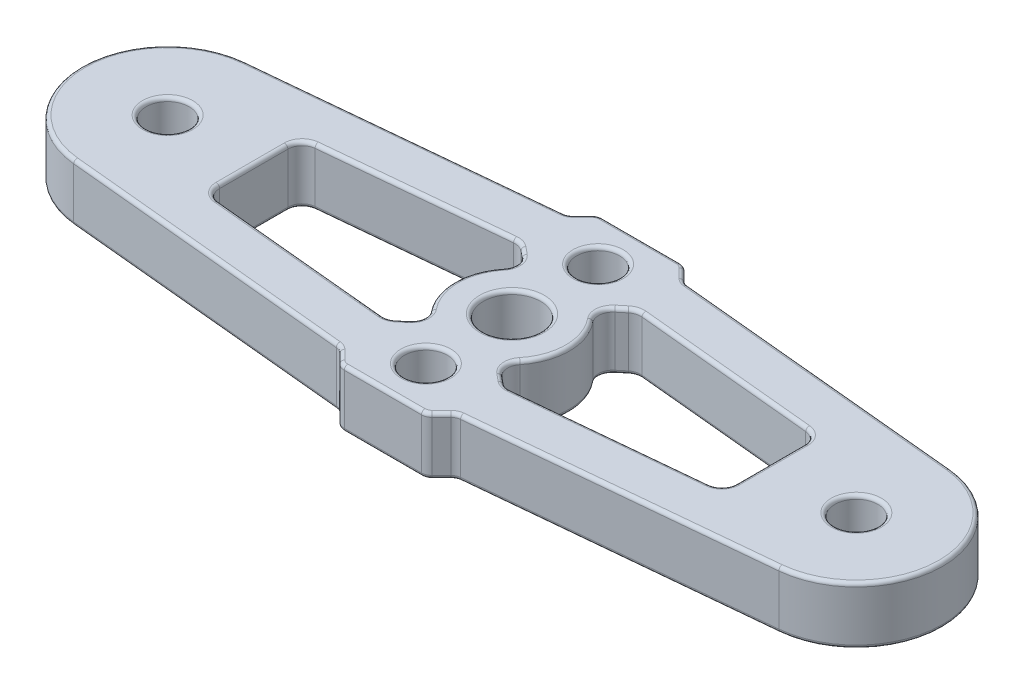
SolidWorks part; units mm, degrees
ref_plane "Ebene vorne" through (0, 0, 0) normal (0, 0, 1) x (1, 0, 0)
ref_plane "Ebene oben" through (0, 0, 0) normal (0, 1, 0) x (1, 0, 0)
ref_plane "Ebene rechts" through (0, 0, 0) normal (1, 0, 0) x (0, 0, -1)
sketch "Skizze1" plane through (0, 0, 0) normal (0, 1, 0) x (1, 0, 0)
  line L0 (0, 0) -> (24, 0) construction
  line L1 (24, 0) -> (24, 6) construction
  line L2 (24, 0) -> (24, -6) construction
  line L3 (24, 0) -> (48, 0) construction
  line L4 (24, 0) -> (24, 9) construction
  line L5 (21, 9) -> (27, 9)
  line L6 (21, -9) -> (27, -9)
  line L7 (21, 9) -> (19.9393, 7.9393)
  line L8 (27, 9) -> (28.0607, 7.9393)
  line L9 (27, -9) -> (28.0607, -7.9393)
  line L10 (21, -9) -> (19.9393, -7.9393)
  line L11 (19.9393, 7.9393) -> (-0.5727, 5.9726)
  line L12 (19.9393, -7.9393) -> (-0.5727, -5.9726)
  line L13 (28.0607, -7.9393) -> (48.5727, -5.9726)
  line L14 (28.0607, 7.9393) -> (48.5727, 5.9726)
  line L15 (6, -3.2877) -> (6, 3.2877)
  line L16 (6, 3.2877) -> (19.9361, 4.6239)
  line L17 (19.9361, 4.6239) -> (21.6326, 3.2242)
  line L18 (19.9361, -4.6239) -> (21.6326, -3.2242)
  line L19 (6, -3.2877) -> (19.9361, -4.6239)
  line L20 (28.0639, -4.6239) -> (26.3674, -3.2242)
  line L21 (42, -3.2877) -> (28.0639, -4.6239)
  line L22 (42, -3.2877) -> (42, 3.2877)
  line L23 (42, 3.2877) -> (28.0639, 4.6239)
  line L24 (28.0639, 4.6239) -> (26.3674, 3.2242)
  arc A0 (-0.5727, 5.9726) -> (-0.5727, -5.9726) centre (0, 0) ccw
  circle A1 centre (24, 0) radius 2
  arc A2 (48.5727, -5.9726) -> (48.5727, 5.9726) centre (48, 0) ccw
  circle A3 centre (24, 6) radius 1.5
  circle A4 centre (24, -6) radius 1.5
  circle A5 centre (0, 0) radius 1.5
  circle A6 centre (48, 0) radius 1.5
  arc A7 (26.3674, -3.2242) -> (26.3674, 3.2242) centre (24, 0) ccw
  arc A8 (21.6326, 3.2242) -> (21.6326, -3.2242) centre (24, 0) ccw
  point P32 (6, 0)
  dimension "D1" = 3
  dimension "D2" = 4
  dimension "D3" = 12
  dimension "D10" = 3
  dimension "D11" = 8
  dimension "D4" = 24
  dimension "D5" = 6
  dimension "D6" = 9
  dimension "D7" = 6
  dimension "D8" = 1.5
  dimension "D9" = 225
  dimension "D12" = 6
  dimension "D13" = 3.3
  dimension "D14" = 14
  dimension "D15" = 135
extrude "Aufsatz-Linear austragen1" add sketch "Skizze1" along normal blind 4
fillet "Verrundung1" radius 1 12 edges at (6, 2, 3.2877) (19.9361, 2, 4.6239) (21.6326, 2, 3.2242) (21.6326, 2, -3.2242) (19.9361, 2, -4.6239) (42, 2, -3.2877) (28.0639, 2, -4.6239) (26.3674, 2, -3.2242) (26.3674, 2, 3.2242) (28.0639, 2, 4.6239) (42, 2, 3.2877) (6, 2, -3.2877)
fillet "Verrundung2" radius 0.75 8 edges at (21, 2, -9) (27, 2, -9) (28.0607, 2, -7.9393) (28.0607, 2, 7.9393) (27, 2, 9) (21, 2, 9) (19.9393, 2, -7.9393) (19.9393, 2, 7.9393)
fillet "Verrundung3" radius 0.25 98 edges at (21.126, 0, -3.2643) (21.126, 0, 3.2643) (19.912, 0, 4.5451) (6.2599, 0, 3.0515) (6.2599, 0, -3.0515) (19.912, 0, -4.5451) (21.126, 4, -3.2643) (21.126, 4, 3.2643) (19.912, 4, 4.5451) (6.2599, 4, 3.0515) (6.2599, 4, -3.0515) (19.912, 4, -4.5451) (26.874, 0, 3.2643) (26.874, 0, -3.2643) (28.088, 0, -4.5451) (41.7401, 0, -3.0515) (41.7401, 0, 3.0515) (28.088, 0, 4.5451) (26.874, 4, 3.2643) (26.874, 4, -3.2643) (28.088, 4, -4.5451) (41.7401, 4, -3.0515) (41.7401, 4, 3.0515) (28.088, 4, 4.5451) (26.9764, 0, -8.9429) (28.0807, 0, -7.9818) (28.0807, 0, 7.9818) (26.9764, 0, 8.9429) (21.0236, 0, 8.9429) (19.9193, 0, 7.9818) (19.9193, 0, -7.9818) (21.0236, 0, -8.9429) (19.9193, 4, -7.9818) (21.0236, 4, -8.9429) (26.9764, 4, -8.9429) (28.0807, 4, -7.9818) (28.0807, 4, 7.9818) (26.9764, 4, 8.9429) (21.0236, 4, 8.9429) (19.9193, 4, 7.9818) (13.2142, 0, -3.9794) (6, 0, 0) (13.2142, 0, 3.9794) (20.5114, 0, 4.1493) (20, 0, 0) (20.5114, 0, -4.1493) (13.2142, 4, -3.9794) (6, 4, 0) (13.2142, 4, 3.9794) (20.5114, 4, 4.1493) (20, 4, 0) (20.5114, 4, -4.1493) (34.7858, 0, 3.9794) (42, 0, 0) (34.7858, 0, -3.9794) (27.4886, 0, -4.1493) (28, 0, 0) (27.4886, 0, 4.1493) (34.7858, 4, 3.9794) (42, 4, 0) (34.7858, 4, -3.9794) (27.4886, 4, -4.1493) (28, 4, 0) (27.4886, 4, 4.1493) (24, 0, 7.5) (24, 4, 7.5) (24, 0, -4.5) (24, 4, -4.5) (48, 0, -1.5) (48, 4, -1.5) (24, 0, 2) (24, 4, 2) (0, 0, 1.5) (0, 4, 1.5) (20.4551, 0, -8.4551) (9.5492, 0, -6.9431) (-6, 0, 0) (9.5492, 0, 6.9431) (20.4551, 0, 8.4551) (24, 0, 9) (27.5449, 0, 8.4551) (38.4508, 0, 6.9431) (54, 0, 0) (38.4508, 0, -6.9431) (27.5449, 0, -8.4551) (24, 0, -9) (20.4551, 4, -8.4551) (9.5492, 4, -6.9431) (-6, 4, 0) (20.4551, 4, 8.4551) (24, 4, 9) (27.5449, 4, 8.4551) (38.4508, 4, 6.9431) (54, 4, 0) (38.4508, 4, -6.9431) (27.5449, 4, -8.4551) (24, 4, -9) (9.5492, 4, 6.9431)
